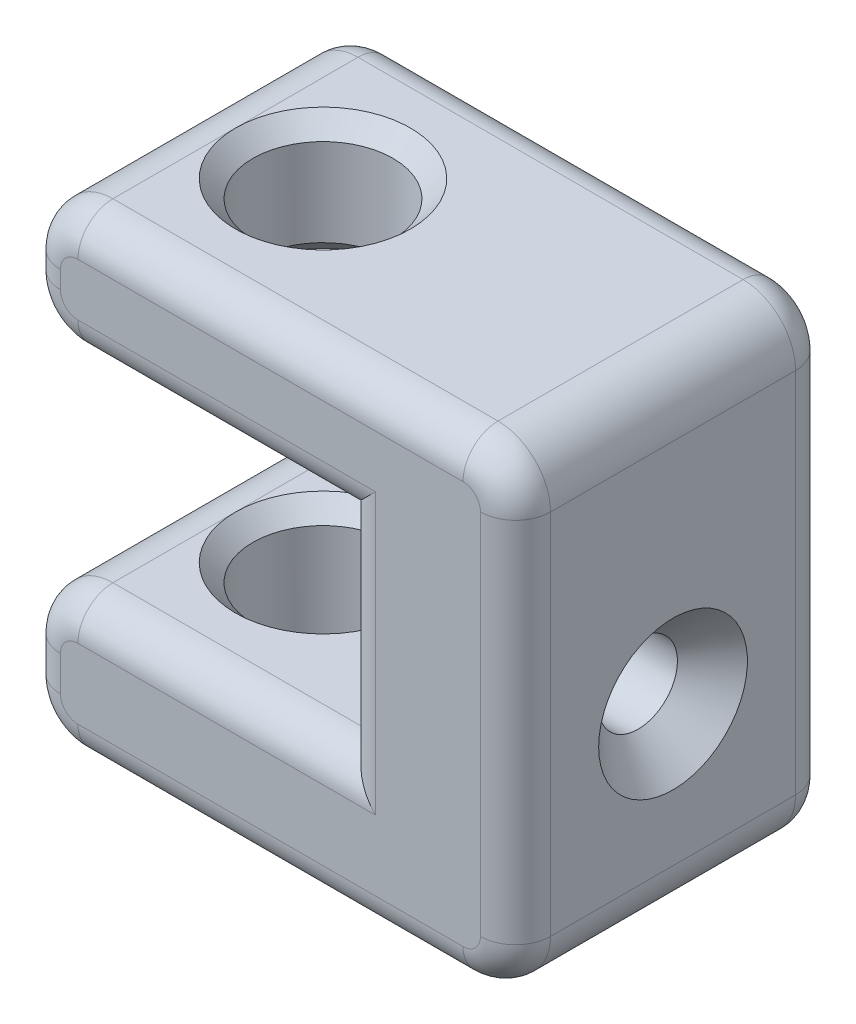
SolidWorks part; units mm, degrees
ref_plane "Plan de face" through (0, 0, 0) normal (0, 0, 1) x (1, 0, 0)
ref_plane "Plan de dessus" through (0, 0, 0) normal (0, 1, 0) x (1, 0, 0)
ref_plane "Plan de droite" through (0, 0, 0) normal (1, 0, 0) x (0, 0, -1)
sketch "Esquisse1" plane through (0, 0, 0) normal (0, 0, 1) x (1, 0, 0)
  line L0 (0, 0) -> (18, 0)
  line L1 (18, 0) -> (18, -12)
  line L2 (18, -12) -> (0, -12)
  line L3 (0, -12) -> (0, -20)
  line L4 (0, -20) -> (28, -20)
  line L5 (28, -20) -> (28, 7)
  line L6 (28, 7) -> (0, 7)
  line L7 (0, 7) -> (0, 0)
  dimension "D1" = 12
  dimension "D2" = 18
  dimension "D3" = 28
  dimension "D4" = 8
  dimension "D5" = 7
extrude "Boss.-Extru.1" add sketch "Esquisse1" along normal blind 18
sketch "Esquisse2" plane through (0, 7, 0) normal (0, 1, 0) x (1, 0, 0)
  circle A0 centre (8, -9) radius 4
  dimension "D1" = 8
extrude "Enlèv. mat.-Extru.1" cut sketch "Esquisse2" against normal through all
chamfer "Chanfrein5" distance 1 angle 45 4 edges at (4, -20, 9) (8, 0, 13) (8, -12, 5) (4, 7, 9)
sketch "Esquisse3" plane through (28, 0, 0) normal (1, 0, 0) x (0, 0, -1)
  circle A0 centre (-9, -9) radius 2.25
  dimension "D1" = 4.5
extrude "Enlèv. mat.-Extru.2" cut sketch "Esquisse3" against normal through all
chamfer "Chanfrein6" distance 2 angle 45 1 edges at (28, -9, 6.75)
fillet "Congé1" radius 3 6 edges at (28, 7, 9) (28, -20, 9) (0, 7, 9) (0, 0, 9) (0, -12, 9) (0, -20, 9)
fillet "Congé2" radius 2 14 edges at (27.1213, -19.1213, 18) (14, -20, 18) (0.8787, -19.1213, 18) (0, -16, 18) (0.8787, -12.8787, 18) (10.5, -12, 18) (18, -6, 18) (10.5, 0, 18) (0.8787, 0.8787, 18) (0, 3.5, 18) (0.8787, 6.1213, 18) (14, 7, 18) (27.1213, 6.1213, 18) (28, -6.5, 18)
fillet "Congé3" radius 2 14 edges at (0.8787, 6.1213, 0) (0, 3.5, 0) (0.8787, 0.8787, 0) (10.5, 0, 0) (18, -6, 0) (10.5, -12, 0) (0.8787, -12.8787, 0) (0, -16, 0) (0.8787, -19.1213, 0) (14, -20, 0) (27.1213, -19.1213, 0) (28, -6.5, 0) (27.1213, 6.1213, 0) (14, 7, 0)
